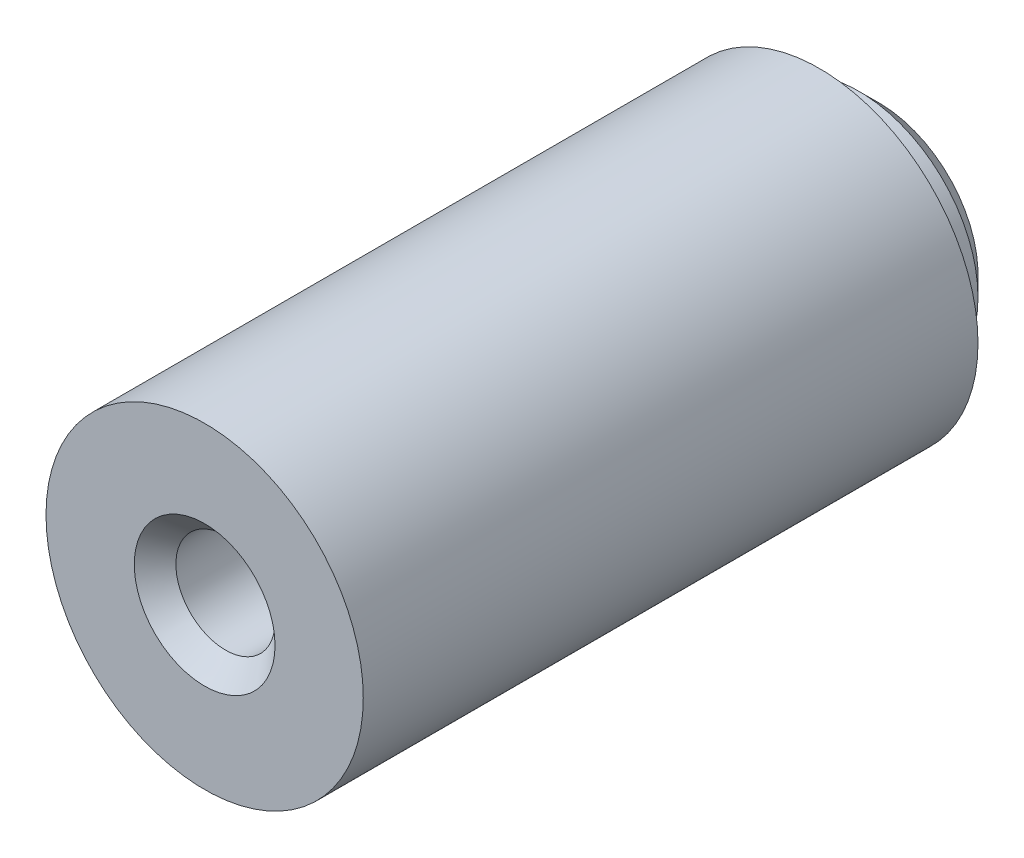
SolidWorks part; units mm, degrees
ref_plane "Přední rovina" through (0, 0, 0) normal (0, 0, 1) x (1, 0, 0)
ref_plane "Horní rovina" through (0, 0, 0) normal (0, 1, 0) x (1, 0, 0)
ref_plane "Pravá rovina" through (0, 0, 0) normal (1, 0, 0) x (0, 0, -1)
sketch "Skica1" plane through (0, 0, 0) normal (0, 0, 1) x (1, 0, 0)
  circle A0 centre (0, 0) radius 4
  dimension "D1" = 8
extrude "Přidat vysunutím1" add sketch "Skica1" along normal blind 15.5
sketch "Skica2" plane through (0, 0, 15.5) normal (0, 0, 1) x (1, 0, 0)
  line L0 (0, 4) -> (0, -4) construction
  line L1 (4, 0) -> (-3.9994, 0.0692) construction
  circle A0 centre (0, 0) radius 4 construction
  point P7 (0.0003, 0.0346)
hole_wizard "M3 závit1" positions "3DSkica1" profile "Skica3" tap size "M3" standard "ISO"
sketch3d "3DSkica1"
  line L0 (4, 0, 15.5) -> (-3.9994, 0.0692, 15.5) construction
  point P0 (0.0003, 0.0346, 15.5)
  point P3 (0.0003, 0.0346, 15.5)
  point P7 (0.0003, 0.0346, 15.5)
sketch "Skica3" plane through (0.0003, 0.0346, 15.5) normal (1, 0, 0) x (0, -1, 0)
  line L0 (0, 0) -> (0, 13.2511)
  line L1 (0, 13.2511) -> (1.25, 12.5)
  line L2 (1.25, 12.5) -> (1.25, 0.525)
  line L3 (1.25, 0.525) -> (1.775, 0)
  line L5 (1.775, 0) -> (0, 0)
  line L6 (-1.25, 0.525) -> (-1.775, 0) construction
  line L10 (0, 13.2511) -> (-1.25, 12.5) construction
  line L11 (0, -6.35) -> (0, 107.95) construction
  dimension "Průměr závitníku" = 2.5
  dimension "Hloubka závitníku" = 12.5
  dimension "Průměr blíz. kuž. zahloubení" = 3.55
  dimension "Úhel blíz. kuž. zahloubení" = 90
  dimension "Úhel vrtání" = 118
sketch "Skica4" plane through (0, 0, 0) normal (0, 0, -1) x (-1, 0, 0)
  circle A0 centre (0, 0) radius 3
extrude "Přidat vysunutím2" add sketch "Skica4" along normal blind 1.5
chamfer "Zkosení1" distance 0.5 angle 45 1 edges at (-3, 0, -1.5)
